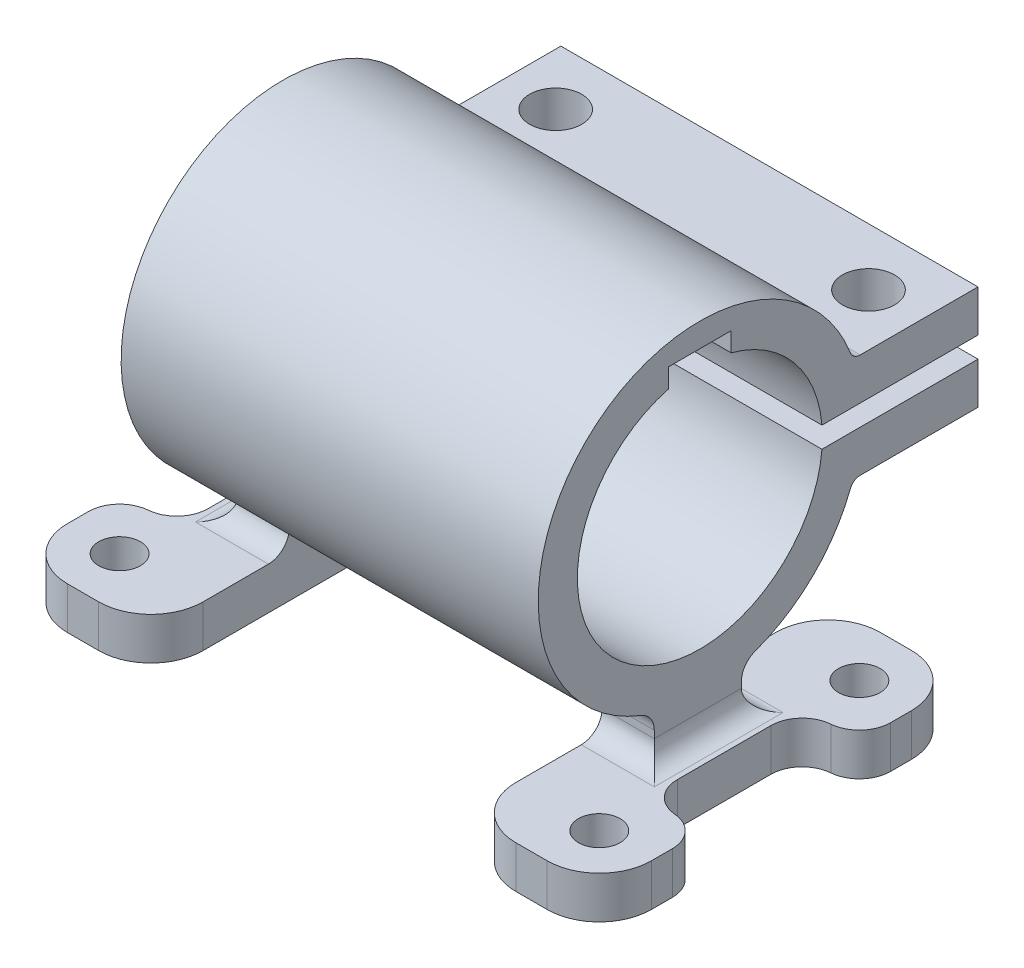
SolidWorks part; units mm, degrees
ref_plane "Plan de face" through (0, 0, 0) normal (0, 0, 1) x (1, 0, 0)
ref_plane "Plan de dessus" through (0, 0, 0) normal (0, 1, 0) x (1, 0, 0)
ref_plane "Plan de droite" through (0, 0, 0) normal (1, 0, 0) x (0, 0, -1)
sketch "Esquisse4" plane through (0, 0, 0) normal (1, 0, 0) x (0, 0, -1)
  line L0 (14.6714, -5) -> (14.6714, 5) construction
  line L1 (14.6714, 5) -> (14.6714, 17.3862) construction
  line L2 (14.6714, 17.3862) -> (14.6714, -9.9434) construction
  line L3 (15.3704, 5) -> (26.6714, 5)
  line L4 (26.6714, 5) -> (26.6714, 1)
  line L5 (26.6714, -5) -> (15.3704, -5)
  line L6 (0, 0) -> (41.9099, 0) construction
  line L7 (11.7074, -1) -> (26.6714, -1)
  line L8 (11.7074, 1) -> (26.6714, 1)
  line L9 (26.6714, -1) -> (26.6714, -5)
  arc A0 (14.4389, 5.6364) -> (14.4389, -5.6364) centre (0, 0) ccw
  arc A1 (15.3704, -5) -> (14.4389, -5.6364) centre (15.3704, -6) ccw
  arc A2 (15.3704, 5) -> (14.4389, 5.6364) centre (15.3704, 6) cw
  arc A3 (11.7074, 1) -> (11.7074, -1) centre (0, 0) ccw
  dimension "D1" = 12
  dimension "D6" = 1
  dimension "D7" = 15.5
  dimension "D8" = 23.5
  dimension "D2" = 90
  dimension "D3" = 270
  dimension "D4" = 90
  dimension "D5" = 10
  dimension "D9" = 2
  dimension "D10" = 1
extrude "Boss.-Extru.2" add sketch "Esquisse4" along normal blind 40
sketch "Esquisse6" plane through (0, 5, 0) normal (0, 1, 0) x (1, 0, 0)
  line L0 (40, 26.6714) -> (0, 26.6714) construction
  line L2 (0, 26.6714) -> (0, 15.3704) construction
  line L3 (40, 26.6714) -> (40, 15.3704) construction
  circle A0 centre (5, 21.1714) radius 2.5
  circle A1 centre (35, 21.1714) radius 2.5
  dimension "D1" = 5
  dimension "D2" = 5
  dimension "D3" = 5.5
  dimension "D4" = 5
  dimension "D5" = 5
  dimension "D6" = 5.5
extrude "Enlèv. mat.-Extru.2" cut sketch "Esquisse6" against normal through all
ref_plane "Plan1" through (35, 0, 0) normal (1, 0, 0) x (0, 0, -1)
sketch "Esquisse7" plane through (35, 0, 0) normal (1, 0, 0) x (0, 0, -1)
  line L0 (0, 0) -> (0, -34.5923) construction
  line L1 (-19.064, 0) -> (45.6132, 0) construction
  line L2 (-4.3748, -14.5) -> (3.9736, -14.5)
  line L3 (-4.3748, -14.5) -> (-4.3748, -19)
  line L4 (-4.3748, -19) -> (3.9736, -19)
  line L5 (3.9736, -14.5) -> (3.9736, -19)
  dimension "D1" = 4.5
  dimension "D2" = 8.3484
  dimension "D3" = 14.5
extrude "Boss.-Extru.3" add sketch "Esquisse7" along normal blind 5
sketch "Esquisse8" plane through (0, -19, 0) normal (0, -1, 0) x (1, 0, 0)
  line L1 (-8, 17.6462) -> (48, 17.6462)
  line L2 (-8, 17.6462) -> (-8, -17.2909)
  line L3 (-8, -17.2909) -> (48, -17.2909)
  line L4 (48, 17.6462) -> (48, -17.2909)
  line L7 (0, 15.5) -> (0, -14.4389) construction
  line L9 (40, -14.4389) -> (40, -3.9736) construction
  dimension "D1" = 17.6462
  dimension "D2" = 17.2909
  dimension "D3" = 8
  dimension "D4" = 8
extrude "Boss.-Extru.4" add sketch "Esquisse8" along normal blind 4.05
sketch "Esquisse9" plane through (0, -23.05, 0) normal (0, -1, 0) x (1, 0, 0)
  line L0 (-8, 17.6462) -> (-8, -17.2909) construction
  line L1 (48, 17.6462) -> (-8, 17.6462) construction
  line L2 (48, -17.2909) -> (48, 17.6462) construction
  line L3 (-8, -17.2909) -> (48, -17.2909) construction
  circle A0 centre (-3, 12.6462) radius 2
  circle A1 centre (43, 12.6462) radius 2
  circle A2 centre (43, -12.2909) radius 2
  circle A3 centre (-3, -12.2909) radius 2
  dimension "D1" = 4
  dimension "D2" = 5
  dimension "D3" = 5
  dimension "D4" = 5
  dimension "D5" = 5
extrude "Enlèv. mat.-Extru.3" cut sketch "Esquisse9" against normal through all
fillet "Congé2" radius 5 4 edges at (-8, -21.025, 17.6462) (-8, -21.025, -17.2909) (48, -21.025, -17.2909) (48, -21.025, 17.6462)
ref_plane "Plan7" through (20, 0, 0) normal (1, 0, 0) x (0, 0, -1)
mirror "Symétrie1" about plane through (20, 0, 0) normal (1, 0, 0) of "Boss.-Extru.3"
sketch "Esquisse10" plane through (0, -23.05, 0) normal (0, -1, 0) x (1, 0, 0)
  line L0 (40, -15.3704) -> (40, -26.6714) construction
  line L1 (5, 20.5554) -> (35, 20.5554)
  line L2 (5, 20.5554) -> (5, -20.2)
  line L3 (5, -20.2) -> (35, -20.2)
  line L4 (35, 20.5554) -> (35, -20.2)
  line L5 (0, -15.3704) -> (0, -26.6714) construction
  dimension "D1" = 5
  dimension "D2" = 5
extrude "Enlèv. mat.-Extru.4" cut sketch "Esquisse10" against normal up to next
fillet "Congé4" radius 5 4 edges at (35, -21.025, 17.6462) (5, -21.025, 17.6462) (5, -21.025, -17.2909) (35, -21.025, -17.2909)
sketch "Esquisse11" plane through (0, -19, 0) normal (0, 1, 0) x (1, 0, 0)
  line L0 (40, 17.2909) -> (43, 17.2909) construction
  line L1 (42.5, 7.2909) -> (51.588, 7.2909)
  line L2 (42.5, 7.2909) -> (42.5, -7.6462)
  line L3 (42.5, -7.6462) -> (51.588, -7.6462)
  line L4 (51.588, 7.2909) -> (51.588, -7.6462)
  line L5 (43, -17.6462) -> (40, -17.6462) construction
  line L6 (40, -15.5) -> (40, 14.4389) construction
  line L7 (0, 14.4389) -> (0, -15.5) construction
  line L8 (-12.664, 7.2909) -> (-2.5, 7.2909)
  line L9 (-12.664, 7.2909) -> (-12.664, -7.6462)
  line L10 (-12.664, -7.6462) -> (-2.5, -7.6462)
  line L11 (-2.5, 7.2909) -> (-2.5, -7.6462)
  point P6 (41.5, -17.6462)
  dimension "D1" = 10
  dimension "D2" = 10
  dimension "D3" = 2.5
  dimension "D4" = 2.5
  dimension "D5" = 10.164
extrude "Enlèv. mat.-Extru.5" cut sketch "Esquisse11" against normal through all
fillet "Congé8" radius 3 4 edges at (-8, -21.025, -7.2909) (-8, -21.025, 7.6462) (48, -21.025, 7.6462) (48, -21.025, -7.2909)
fillet "Congé9" radius 3 4 edges at (-2.5, -21.025, -7.2909) (42.5, -21.025, 7.6462) (42.5, -21.025, -7.2909) (-2.5, -21.025, 7.6462)
sketch "Esquisse12" plane through (0, 0, 0) normal (-1, 0, 0) x (0, 0, 1)
  line L0 (0, 0) -> (0, -34.5923) construction
  line L1 (-3, 13.2) -> (3, 13.2)
  line L2 (-3, 13.2) -> (-3, 10.149)
  line L3 (-3, 10.149) -> (3, 10.149)
  line L4 (3, 13.2) -> (3, 10.149)
  line L5 (19.064, 0) -> (-45.6132, 0) construction
  dimension "D1" = 6
  dimension "D2" = 3
  dimension "D3" = 13.2
extrude "Enlèv. mat.-Extru.6" cut sketch "Esquisse12" against normal through all
fillet "Congé10" radius 2 6 edges at (37.5, -19, -3.9736) (40, -19, 0.2006) (37.5, -19, 4.3748) (2.5, -19, 4.3748) (0, -19, 0.2006) (2.5, -19, -3.9736)
fillet "Congé11" radius 2 4 edges at (2.5, -14.8698, 4.3748) (37.5, -14.8698, 4.3748) (37.5, -14.982, -3.9736) (2.5, -14.982, -3.9736)
